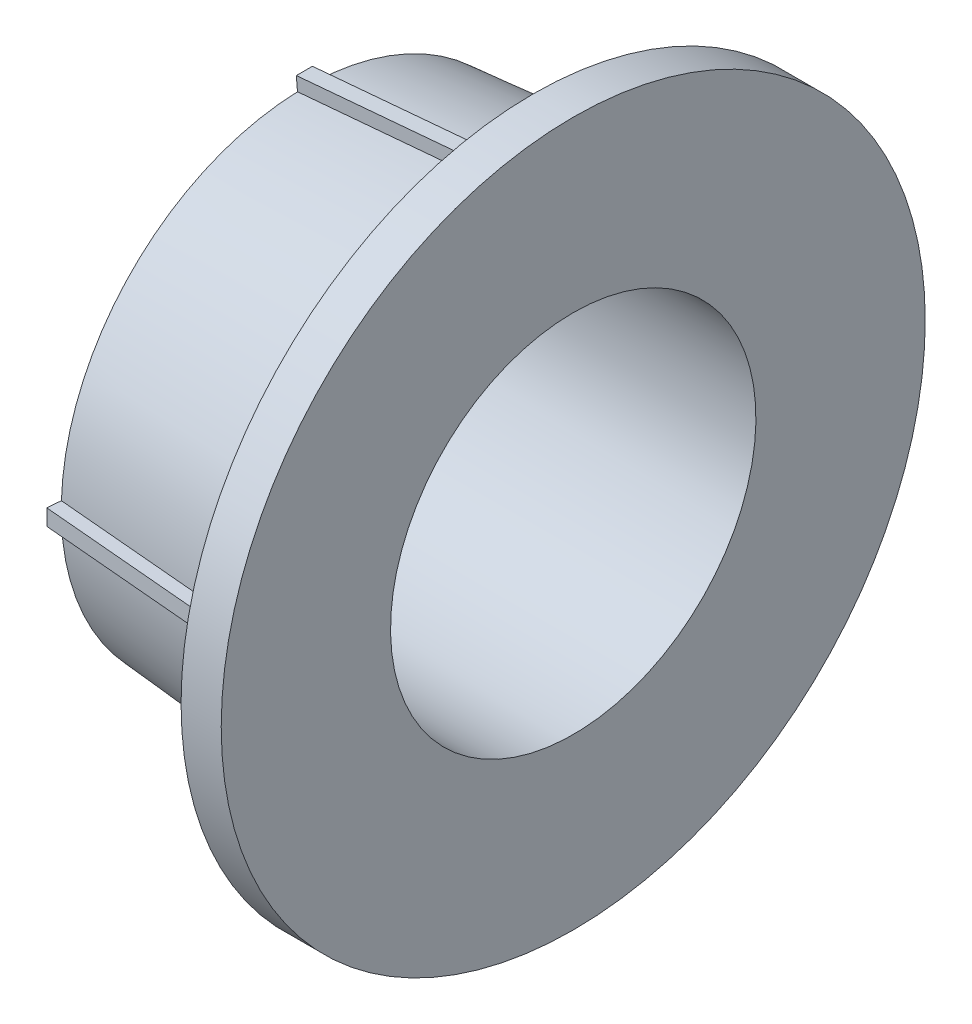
SolidWorks part; units mm, degrees
ref_plane "Plan de face" through (0, 0, 0) normal (0, 0, 1) x (1, 0, 0)
ref_plane "Plan de dessus" through (0, 0, 0) normal (0, 1, 0) x (1, 0, 0)
ref_plane "Plan de droite" through (0, 0, 0) normal (1, 0, 0) x (0, 0, -1)
sketch "Esquisse1" plane through (0, 0, 0) normal (0, 0, 1) x (1, 0, 0)
  line L0 (17, 55.99) -> (17, 29.69)
  line L1 (17, 29.69) -> (20, 29.69)
  line L2 (20, 29.69) -> (20, 55.99)
  line L3 (20, 55.99) -> (17, 55.99)
  line L4 (17, 29.69) -> (20, 29.69) construction
  point P7 (20.6932, 29.9305)
  dimension "D1" = 26.3
  dimension "D2" = 3
  dimension "D3" = 29.69
  dimension "D4" = 20
revolve "Révolution1" add sketch "Esquisse1" angle 360 about L4
sketch "Esquisse2" plane through (17, 0, 0) normal (-1, 0, 0) x (0, 0, 1)
  circle A0 centre (0, 29.69) radius 19.7375
extrude "Boss.-Extru.1" add sketch "Esquisse2" along normal blind 17 draft 5.001
ref_plane "Plan4" through (-4.25, 48.572, 0) normal (-0.0872, 0.9962, 0) x (-0.9962, -0.0872, 0)
sketch "Esquisse3" plane through (-4.25, 48.572, 0) normal (-0.0872, 0.9962, 0) x (-0.9962, -0.0872, 0)
  line L0 (-4.1779, -0.6) -> (-4.1779, 0.6)
  line L1 (-4.1779, 0.6) -> (-21.2437, 0.6)
  line L2 (-21.2437, 0.6) -> (-21.2437, -0.6)
  line L3 (-21.2437, -0.6) -> (-4.1779, -0.6)
extrude "Boss.-Extru.2" add sketch "Esquisse3" against normal up to next
pattern_circular "Répétition circulaire1" count 4 every 90 about axis through (0, 29.69, 0) along (1, 0, 0) of "Boss.-Extru.2"
sketch "Esquisse9" plane through (20, 0, 0) normal (1, 0, 0) x (0, 0, -1)
  circle A0 centre (0, 29.69) radius 13.65
  dimension "D1" = 27.3
extrude "Enlèv. mat.-Extru.1" cut sketch "Esquisse9" against normal through all
